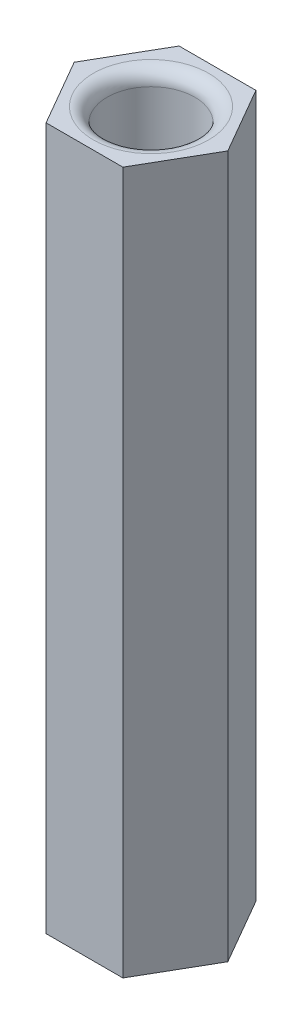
SolidWorks part; units mm, degrees
other "<MirrorMecanumSpacer.0002>-<<MecanumSpacer.0002>-<Imported1>>"
ref_plane "Front Plane" through (0, 0, 0) normal (0, 0, 1) x (1, 0, 0)
ref_plane "Top Plane" through (0, 0, 0) normal (0, 1, 0) x (1, 0, 0)
ref_plane "Right Plane" through (0, 0, 0) normal (1, 0, 0) x (0, 0, -1)
mirrored part "MirrorMecanumSpacer.0002_Mirrored"
